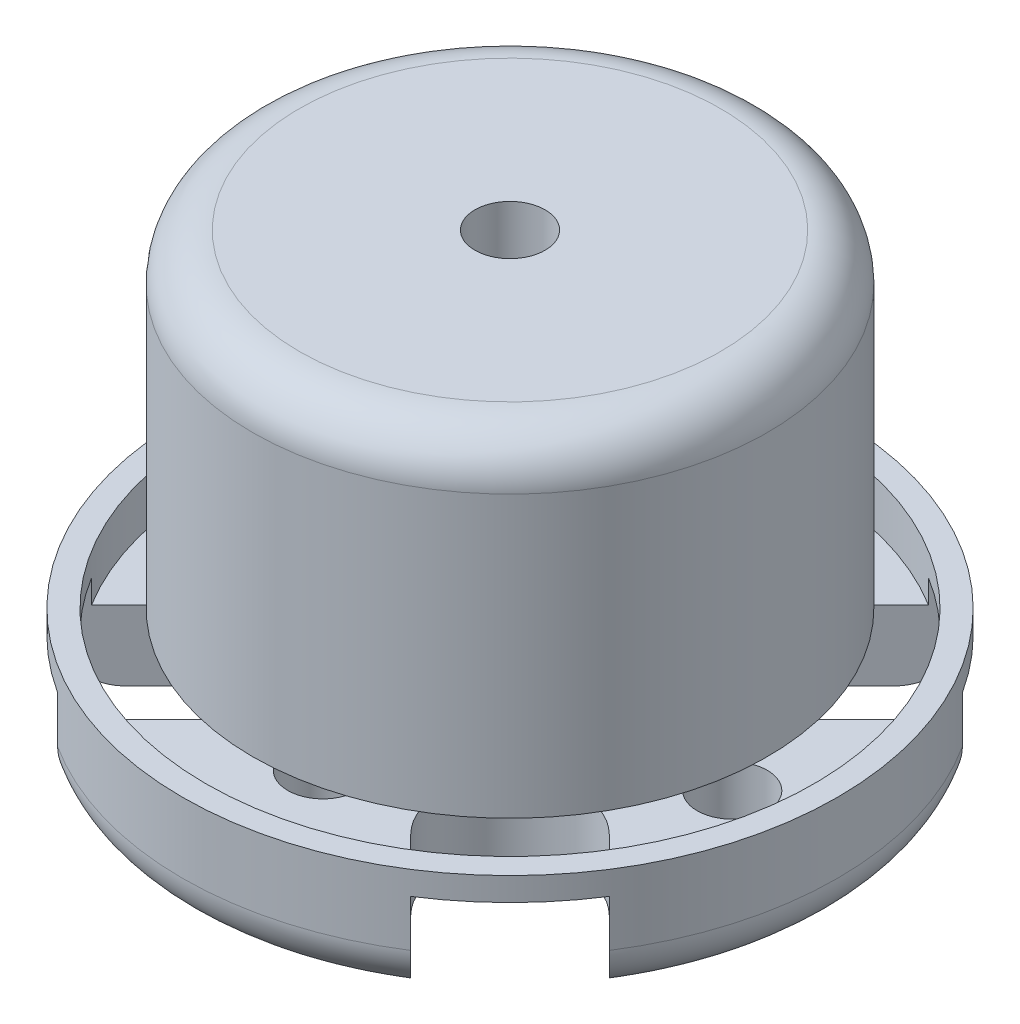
SolidWorks part; units mm, degrees
ref_plane "前视基准面" through (0, 0, 0) normal (0, 0, 1) x (1, 0, 0)
ref_plane "上视基准面" through (0, 0, 0) normal (0, 1, 0) x (1, 0, 0)
ref_plane "右视基准面" through (0, 0, 0) normal (1, 0, 0) x (0, 0, -1)
sketch "草图1" plane through (0, 0, 0) normal (0, 1, 0) x (1, 0, 0)
  line L0 (-19.171, 0) -> (19.0369, 0) construction
  line L1 (0, 16.7875) -> (0, -18.6623) construction
  circle A0 centre (0, 0) radius 14
  circle A1 centre (0, 0) radius 9.5 construction
  circle A2 centre (0, 0) radius 8 construction
  circle A3 centre (-9.5, 0) radius 1.5
  circle A4 centre (9.5, 0) radius 1.5
  circle A5 centre (0, 8) radius 1.5
  circle A6 centre (0, -8) radius 1.5
  dimension "D1" = 28
  dimension "D2" = 19
  dimension "D3" = 16
  dimension "D4" = 3
extrude "凸台-拉伸1" add sketch "草图1" along normal blind 5
sketch "草图2" plane through (0, 5, 0) normal (0, 1, 0) x (1, 0, 0)
  circle A0 centre (0, 0) radius 4.5
  circle A1 centre (0, 0) radius 13
  dimension "D1" = 26
  dimension "D2" = 9
extrude "切除-拉伸1" cut sketch "草图2" against normal blind 2
sketch "草图3" plane through (0, 5, 0) normal (0, 1, 0) x (1, 0, 0)
  circle A0 centre (0, 0) radius 1.5
  dimension "D1" = 3
extrude "切除-拉伸2" cut sketch "草图3" against normal through all
sketch "草图4" plane through (0, 0, 0) normal (0, -1, 0) x (1, 0, 0)
  circle A0 centre (0, 0) radius 4
  dimension "D1" = 8
extrude "切除-拉伸3" cut sketch "草图4" against normal blind 3
sketch "草图5" plane through (0, 0, 0) normal (0, -1, 0) x (1, 0, 0)
  line L0 (0, 0) -> (9.8995, 9.8995) construction
  line L1 (8.4853, 4.2426) -> (11.7909, 7.5482)
  line L2 (4.2426, 8.4853) -> (7.5482, 11.7909)
  line L3 (8.4853, -4.2426) -> (11.7909, -7.5482)
  line L4 (4.2426, -8.4853) -> (7.5482, -11.7909)
  line L5 (-4.2426, -8.4853) -> (-7.5482, -11.7909)
  line L6 (-8.4853, -4.2426) -> (-11.7909, -7.5482)
  line L7 (-8.4853, 4.2426) -> (-11.7909, 7.5482)
  line L8 (-4.2426, 8.4853) -> (-7.5482, 11.7909)
  arc A0 (4.2426, 8.4853) -> (8.4853, 4.2426) centre (6.364, 6.364) ccw
  arc A1 (11.7909, 7.5482) -> (7.5482, 11.7909) centre (0, 0) ccw
  arc A2 (8.4853, -4.2426) -> (4.2426, -8.4853) centre (6.364, -6.364) ccw
  arc A3 (7.5482, -11.7909) -> (11.7909, -7.5482) centre (0, 0) ccw
  arc A4 (-4.2426, -8.4853) -> (-8.4853, -4.2426) centre (-6.364, -6.364) ccw
  arc A5 (-11.7909, -7.5482) -> (-7.5482, -11.7909) centre (0, 0) ccw
  arc A6 (-8.4853, 4.2426) -> (-4.2426, 8.4853) centre (-6.364, 6.364) ccw
  arc A7 (-7.5482, 11.7909) -> (-11.7909, 7.5482) centre (0, 0) ccw
  point P26 (0, 0)
  dimension "D1" = 6
  dimension "D2" = 9
  dimension "D3" = 4
extrude "切除-拉伸4" cut sketch "草图5" against normal blind 4
fillet "圆角1" radius 2 4 edges at (0, 0, -14) (14, 0, 0) (-14, 0, 0) (0, 0, 14)
sketch "草图6" plane through (0, 5, 0) normal (0, 1, 0) x (1, 0, 0)
  circle A0 centre (0, 0) radius 11
  circle A1 centre (0, 0) radius 1.5
  dimension "D1" = 22
extrude "凸台-拉伸3" add sketch "草图6" along normal blind 14
fillet "圆角2" radius 2 1 edges at (0, 19, 11)
